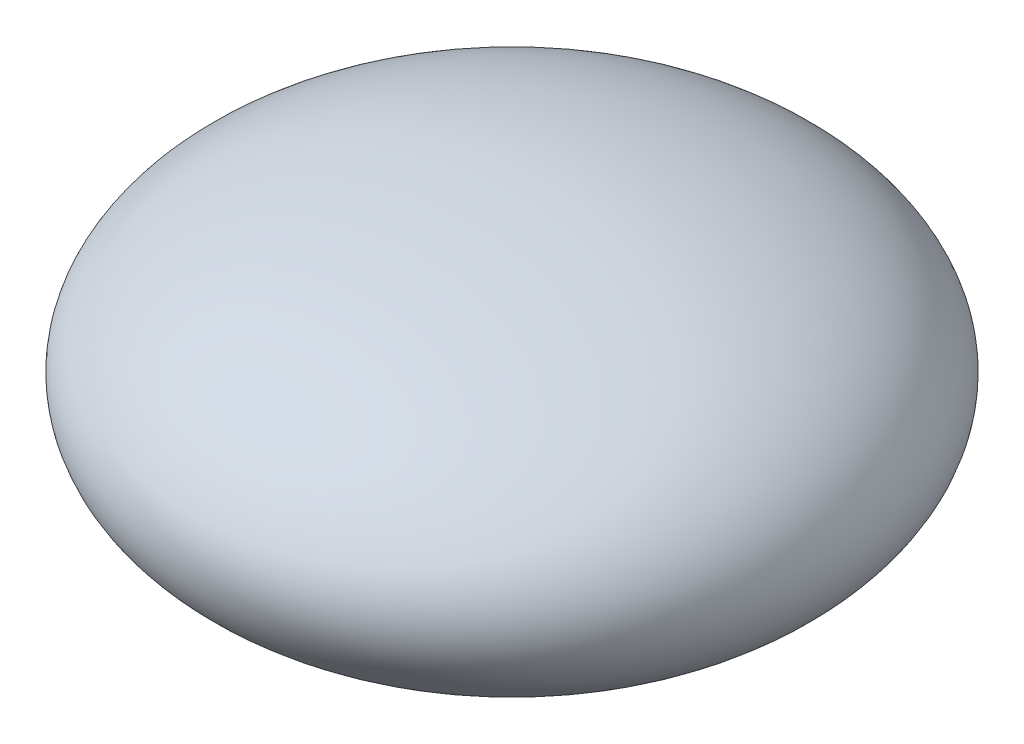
SolidWorks part; units mm, degrees
ref_plane "Front Plane" through (0, 0, 0) normal (0, 0, 1) x (1, 0, 0)
ref_plane "Top Plane" through (0, 0, 0) normal (0, 1, 0) x (1, 0, 0)
ref_plane "Right Plane" through (0, 0, 0) normal (1, 0, 0) x (0, 0, -1)
sketch "Sketch1" plane through (0, 0, 0) normal (0, 0, 1) x (1, 0, 0)
  line L0 (0, 38.1) -> (0, -38.1) construction
  line L1 (0, 38.1) -> (0, -38.1)
  ellipse E0 centre (0, 0) end of major axis (-79.375, 0) minor radius 38.1 (0, 38.1) -> (0, -38.1) ccw
  dimension "D1" = 38.1
  dimension "D2" = 79.375
revolve "Revolve1" add sketch "Sketch1" angle 360 about L0
